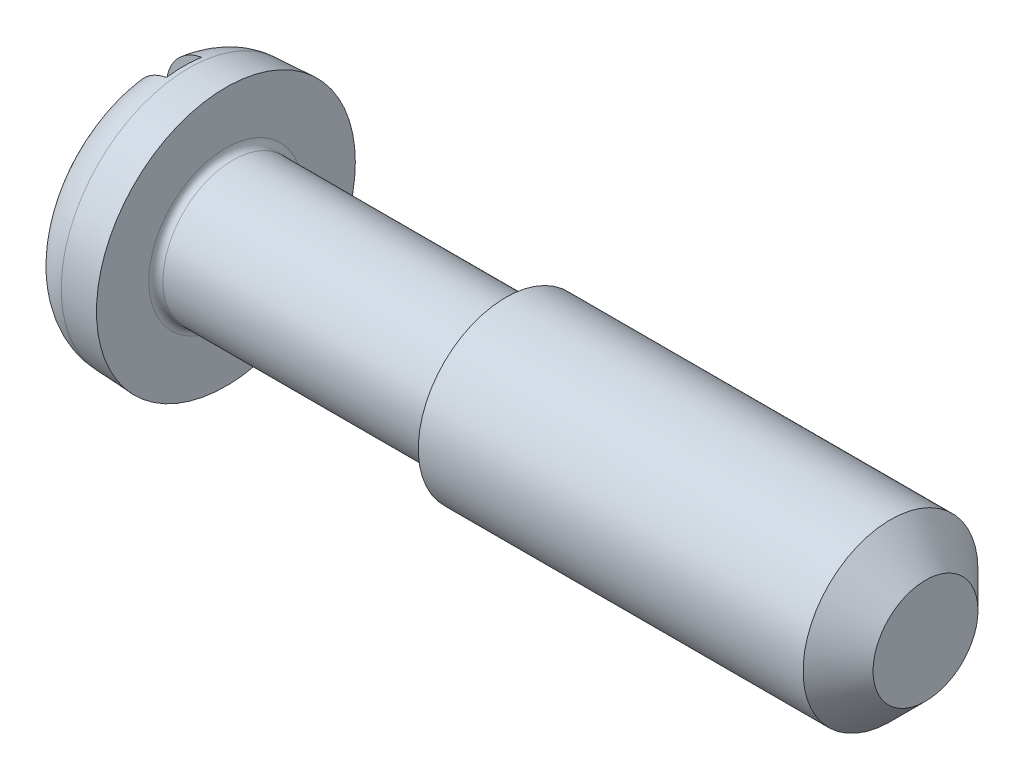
SolidWorks part; units mm, degrees
ref_plane "Front" through (0, 0, 0) normal (0, 0, 1) x (1, 0, 0)
ref_plane "Top" through (0, 0, 0) normal (0, 1, 0) x (1, 0, 0)
ref_plane "Right" through (0, 0, 0) normal (1, 0, 0) x (0, 0, -1)
ref_plane "Plane1" through (1.1, 0, 0) normal (1, 0, 0) x (0, 0, -1)
sketch "Sketch1" plane through (1.1, 0, 0) normal (1, 0, 0) x (0, 0, -1)
  circle A0 centre (0, 0) radius 1.85
  dimension "dk" = 3.7
extrude "BaseHead" add sketch "Sketch1" against normal blind 1.1 draft 3
sketch "Sketch2" plane through (1.1, 0.2245, -0.1603) normal (1, 0, 0) x (0, 0, -1)
  circle A0 centre (-0.1603, -0.2245) radius 1
  circle A1 centre (-0.1603, -0.2245) radius 1.85 construction
  dimension "d1" = 2
extrude "BaseBody" add sketch "Sketch2" along normal blind 10
fillet "HeadFillet" radius 0.6 1 edges at (0, 0, -1.7924)
sketch "Sketch3" plane through (-0.85, 0, 0.85) normal (0, 1, 0) x (0, 0, -1)
  line L1 (0.6, -0.85) -> (1.1, -0.85)
  line L2 (0.6, -0.85) -> (0.6, -1.35)
  line L3 (0.6, -1.35) -> (1.1, -1.35)
  line L4 (1.1, -0.85) -> (1.1, -1.35)
  dimension "n" = 0.5
  dimension "m" = 0.25
  dimension "t" = 0.5
extrude "Slot" cut sketch "Sketch3" against normal through all and the other way through all
sketch "Sketch4" plane through (11.1, -0.1571, -0.7581) normal (1, 0, 0) x (0, 0, -1)
  circle A0 centre (-0.7581, 0.1571) radius 1.25
  circle A1 centre (-0.7581, 0.1571) radius 1 construction
  dimension "d" = 2.5
extrude "BaseEnd" add sketch "Sketch4" against normal blind 6
chamfer "Chamfer1" distance 0.5 angle 45 1 edges at (11.1, 0, -1.25)
fillet "Fillet1" radius 0.1 2 edges at (1.1, 0, -1) (5.1, 0, -1)
sketch "Sketch5" plane through (0, 0, 0) normal (0, 0, 1) x (1, 0, 0)
  line L0 (5.1, 0.9252) -> (5.2875, 1.25)
  line L1 (5.2875, 1.25) -> (5.2875, 1.625)
  line L2 (5.2875, 1.625) -> (4.9125, 1.625)
  line L3 (4.9125, 1.625) -> (4.9125, 1.25)
  line L4 (4.9125, 1.25) -> (5.1, 0.9252)
  line L6 (5.1, 1.25) -> (5.1, -1.25) construction
  line L7 (0, 0) -> (6.6036, 0) construction
  line L8 (0, 1.1971) -> (0, -1.1971) construction
  dimension "D1" = 2.5
  dimension "D2" = 0.375
revolve "Cut-Revolve10" [suppressed] cut sketch "Sketch5" angle 360 about L7
pattern_linear "LPattern10" [suppressed] count 13 spacing 0.45 along (1, 0, 0)
equation "\"m@Sketch3\" = \"n@Sketch3\" / 2"
equation "\"D1@Plane1\"=\"k@BaseHead\""
equation "\"D1@Sketch5\" = \"d@Sketch4\""
equation "\"D2@Sketch5\" =  ( \"d@Sketch4\" - \"THD_MINOR@ThreadCosmetic1\" )  / 2"
equation "\"D3@LPattern10\" = \"D2@Sketch5\" * 1.2"
equation "\"D1@LPattern10\" = \"b@BaseEnd\" / \"D3@LPattern10\""
